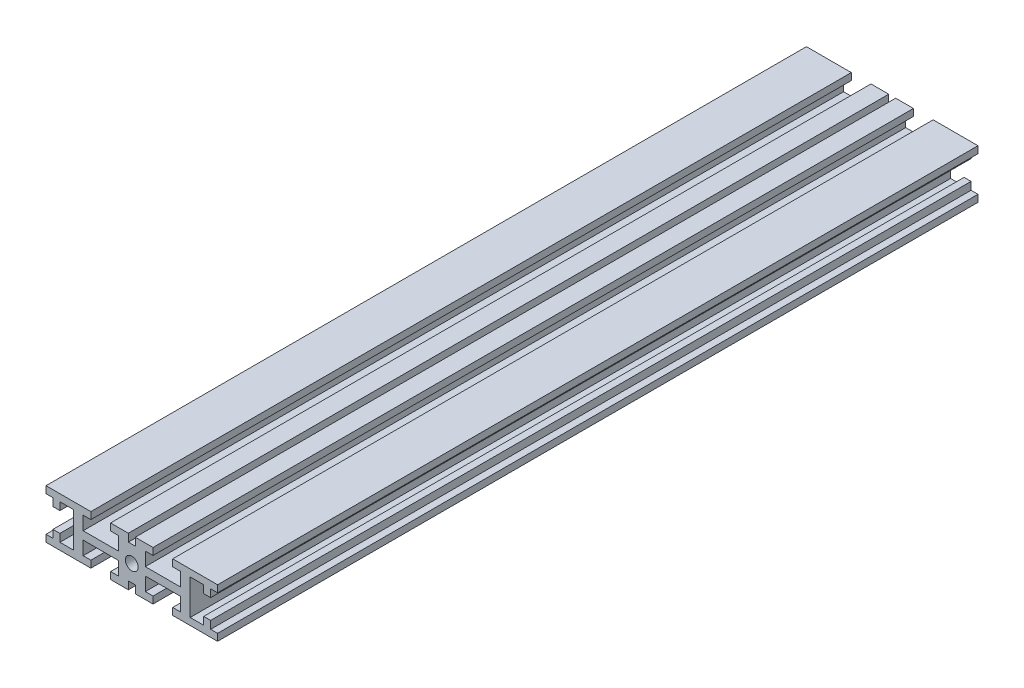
SolidWorks part; units mm, degrees
ref_plane "Front Plane" through (0, 0, 0) normal (0, 0, 1) x (1, 0, 0)
ref_plane "Top Plane" through (0, 0, 0) normal (0, 1, 0) x (1, 0, 0)
ref_plane "Right Plane" through (0, 0, 0) normal (1, 0, 0) x (0, 0, -1)
sketch "Sketch1" plane through (0, 0, 0) normal (0, 0, 1) x (1, 0, 0)
  line L0 (5.5, 6.35) -> (-5.5, 6.35)
  line L1 (-10.6, 6.35) -> (-22.225, 6.35)
  line L2 (-5.5, -6.35) -> (5.5, -6.35)
  line L3 (-3.5, 1.05) -> (-12.6, 1.05)
  line L4 (-20.425, 2.55) -> (-20.425, 4.55)
  line L5 (-3.5, -1.05) -> (-12.6, -1.05)
  line L6 (0, -6.35) -> (0, 6.35) construction
  line L7 (3.5, 4.55) -> (3.5, 1.05)
  line L8 (12.6, 1.05) -> (12.6, 4.55)
  line L9 (5.5, -4.55) -> (3.5, -4.55)
  line L10 (22.225, -6.35) -> (10.6, -6.35)
  line L11 (-12.6, 4.55) -> (-10.6, 4.55)
  line L12 (12.6, -1.05) -> (12.6, -4.55)
  line L13 (-10.6, 4.55) -> (-10.6, 6.35)
  line L14 (5.5, -4.55) -> (5.5, -6.35)
  line L15 (-15.125, 4.55) -> (-18.625, 4.55)
  line L16 (10.6, -4.55) -> (10.6, -6.35)
  line L17 (3.5, -4.55) -> (3.5, -1.05)
  line L18 (12.6, -4.55) -> (10.6, -4.55)
  line L19 (20.425, -2.55) -> (20.425, -4.55)
  line L20 (18.625, 2.55) -> (20.425, 2.55)
  line L21 (-3.5, 4.55) -> (-5.5, 4.55)
  line L22 (18.625, -2.55) -> (20.425, -2.55)
  line L23 (-5.5, 4.55) -> (-5.5, 6.35)
  line L24 (15.125, 4.55) -> (15.125, -4.55)
  line L25 (18.625, -4.55) -> (15.125, -4.55)
  line L26 (18.625, -4.55) -> (18.625, -2.55)
  line L27 (18.625, 4.55) -> (18.625, 2.55)
  line L28 (5.5, 4.55) -> (5.5, 6.35)
  line L29 (3.5, 4.55) -> (5.5, 4.55)
  line L30 (15.125, 4.55) -> (18.625, 4.55)
  line L31 (-18.625, 4.55) -> (-18.625, 2.55)
  line L32 (-18.625, -4.55) -> (-18.625, -2.55)
  line L33 (-18.625, -4.55) -> (-15.125, -4.55)
  line L34 (-15.125, 4.55) -> (-15.125, -4.55)
  line L35 (-18.625, -2.55) -> (-20.425, -2.55)
  line L36 (-18.625, 2.55) -> (-20.425, 2.55)
  line L37 (10.6, 4.55) -> (10.6, 6.35)
  line L38 (-20.425, 4.55) -> (-22.225, 4.55)
  line L39 (12.6, 4.55) -> (10.6, 4.55)
  line L40 (3.5, -1.05) -> (12.6, -1.05)
  line L41 (-12.6, -4.55) -> (-10.6, -4.55)
  line L42 (20.425, -4.55) -> (22.225, -4.55)
  line L43 (3.5, 1.05) -> (12.6, 1.05)
  line L44 (10.6, 6.35) -> (22.225, 6.35)
  line L45 (-22.225, -6.35) -> (-22.225, -4.55)
  line L46 (-3.5, -4.55) -> (-3.5, -1.05)
  line L47 (-22.225, 6.35) -> (-22.225, 4.55)
  line L48 (-10.6, -4.55) -> (-10.6, -6.35)
  line L49 (-20.425, -2.55) -> (-20.425, -4.55)
  line L50 (-5.5, -4.55) -> (-5.5, -6.35)
  line L51 (-20.425, -4.55) -> (-22.225, -4.55)
  line L52 (22.225, -4.55) -> (22.225, -6.35)
  line L53 (20.425, 2.55) -> (20.425, 4.55)
  line L54 (20.425, 4.55) -> (22.225, 4.55)
  line L55 (-12.6, -1.05) -> (-12.6, -4.55)
  line L56 (22.225, 4.55) -> (22.225, 6.35)
  line L57 (-22.225, -6.35) -> (-10.6, -6.35)
  line L59 (-5.5, -4.55) -> (-3.5, -4.55)
  line L63 (-12.6, 1.05) -> (-12.6, 4.55)
  line L65 (-3.5, 4.55) -> (-3.5, 1.05)
  point P14 (-5.5, -5.45)
  point P15 (-10.6, -5.45)
  dimension "D11" = 6.35
  dimension "D16" = 2
  dimension "D6" = 12.7
  dimension "D8" = 5.5
  dimension "D5" = 1.8
  dimension "D7" = 5.1
  dimension "D9" = 5.5
  dimension "D10" = 3.5
  dimension "D12" = 2
  dimension "D13" = 1.8
  dimension "D14" = 44.45
  dimension "D15" = 1.8
  dimension "D17" = 3.5
  dimension "D18" = 1.8
  dimension "D19" = 2
  dimension "D20" = 1.8
  dimension "D22" = 2
  dimension "D23" = 1.8
  dimension "D26" = 2
  dimension "D27" = 2
  dimension "D29" = 3.5
  dimension "D33" = 9.1
  dimension "D41" = 1.8
extrude "Boss-Extrude1" add sketch "Sketch1" along normal blind 197
sketch "Sketch2" plane through (0, 0, 197) normal (0, 0, 1) x (1, 0, 0)
  circle A1 centre (0, 0) radius 2
  dimension "D3" = 4
hole_wizard "M4 Tapped Hole1" positions "3DSketch1" profile "Sketch3" tap size "M4" standard "DIN"
sketch3d "3DSketch1"
  point P0 (0, 0, 197)
sketch "Sketch3" plane through (0, 0, 197) normal (1, 0, 0) x (0, -1, 0)
  line L0 (0, 0) -> (0, 197)
  line L1 (0, 197) -> (1.65, 197)
  line L2 (1.65, 197) -> (1.65, 0)
  line L5 (1.65, 0) -> (0, 0)
  line L11 (0, -6.35) -> (0, 107.95) construction
  dimension "Thru Tap Drill Dia." = 3.3
  dimension "Thru Tap Drill Depth" = 197
sketch "Sketch5" plane through (0, 0, 197) normal (0, 0, 1) x (1, 0, 0)
  line L2 (-0.9, -6.35) -> (0.9, -6.35)
  line L3 (-0.9, -6.35) -> (-0.9, -4.35)
  line L4 (-0.9, -4.35) -> (0.9, -4.35)
  line L5 (0.9, -6.35) -> (0.9, -4.35)
  line L6 (0.9, 6.35) -> (-0.9, 6.35)
  line L7 (0.9, 6.35) -> (0.9, 4.35)
  line L8 (0.9, 4.35) -> (-0.9, 4.35)
  line L9 (-0.9, 6.35) -> (-0.9, 4.35)
  line L11 (-5.5, -6.35) -> (5.5, -6.35) construction
  line L22 (5.5, 6.35) -> (-5.5, 6.35) construction
  point P4 (0, 4.35)
  dimension "D1" = 1.8
  dimension "D2" = 2
  dimension "D3" = 2
  dimension "D6" = 1.8
extrude "Cut-Extrude1" cut sketch "Sketch5" against normal through all
